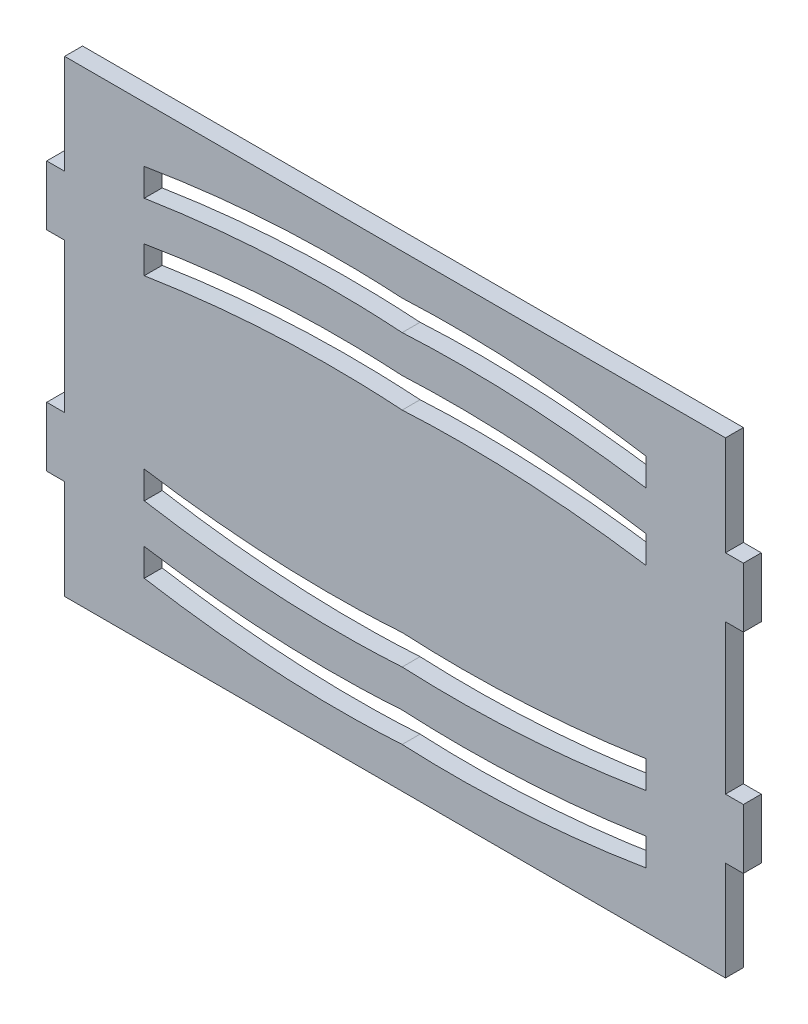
SolidWorks part; units mm, degrees
ref_plane "Front Plane" through (0, 0, 0) normal (0, 0, 1) x (1, 0, 0)
ref_plane "Top Plane" through (0, 0, 0) normal (0, 1, 0) x (1, 0, 0)
ref_plane "Right Plane" through (0, 0, 0) normal (1, 0, 0) x (0, 0, -1)
sketch "Sketch1" plane through (0, 0, 0) normal (0, 0, 1) x (1, 0, 0)
  line L1 (342, -235) -> (-342, -235)
  line L2 (342, -235) -> (342, 235)
  line L3 (342, 235) -> (-342, 235)
  line L4 (-342, -235) -> (-342, 235)
  line L5 (342, -235) -> (-342, 235) construction
  line L6 (342, 235) -> (-342, -235) construction
  point P0 (0, 0)
  dimension "D1" = 684
  dimension "D2" = 470
extrude "Boss-Extrude1" add sketch "Sketch1" along normal blind 18
sketch "Sketch2" plane through (0, 0, 0) normal (0, 0, 1) x (1, 0, 0)
  line L0 (-252, 179.19) -> (-252, 151.5066)
  line L1 (7.1609, 194.19) -> (7.1609, 164.19)
  line L2 (252, 179.19) -> (252, 151.5066)
  line L3 (-342, -33.7) -> (342, -33.7)
  line L4 (-252, 111.79) -> (-252, 84.1066)
  line L5 (342, -235) -> (342, 235) construction
  line L6 (-342, 235) -> (-342, -235) construction
  line L7 (-342, 0) -> (342, 0) construction
  line L8 (252, -179.19) -> (252, -151.5066)
  line L9 (-252, -179.19) -> (-252, -151.5066)
  line L10 (-342, 0) -> (342, 0)
  line L12 (252, 111.79) -> (252, 84.1066)
  line L13 (-342, 33.7) -> (342, 33.7)
  line L14 (-252, -111.79) -> (-252, -84.1066)
  line L15 (252, -111.79) -> (252, -84.1066)
  spline S0 degree 2 poles (-252, 179.19) (-118.0184, 201.926) (7.1609, 194.19) knots 0 0 0 0.511096 0.511096 0.511096
  spline S1 degree 2 poles (-252, 151.5066) (-117.9662, 172.5949) (7.1609, 164.19) knots 0 0 0 0.510889 0.510889 0.510889
  spline S2 degree 2 poles (252, 179.19) (125.3883, 199.9001) (7.1609, 194.19) knots 0 0 0 0.482354 0.482354 0.482354
  spline S3 degree 2 poles (252, 151.5066) (125.3402, 170.5851) (7.1609, 164.19) knots 0 0 0 0.482141 0.482141 0.482141
  spline S4 degree 2 poles (252, -151.5066) (125.3402, -170.5851) (7.1609, -164.19) knots 0 0 0 0.482141 0.482141 0.482141
  spline S5 degree 2 poles (252, -179.19) (125.3883, -199.9001) (7.1609, -194.19) knots 0 0 0 0.482354 0.482354 0.482354
  spline S6 degree 2 poles (-252, -179.19) (-118.0184, -201.926) (7.1609, -194.19) knots 0 0 0 0.511096 0.511096 0.511096
  spline S7 degree 2 poles (-252, -151.5066) (-117.9662, -172.5949) (7.1609, -164.19) knots 0 0 0 0.510889 0.510889 0.510889
  spline S8 degree 2 poles (252, 111.79) (125.3883, 132.5001) (7.1609, 126.79) knots 0 0 0 0.482354 0.482354 0.482354
  spline S9 degree 2 poles (252, 84.1066) (125.3402, 103.1851) (7.1609, 96.79) knots 0 0 0 0.482141 0.482141 0.482141
  spline S10 degree 2 poles (-252, 84.1066) (-117.9662, 105.1949) (7.1609, 96.79) knots 0 0 0 0.510889 0.510889 0.510889
  spline S11 degree 2 poles (-252, 111.79) (-118.0184, 134.526) (7.1609, 126.79) knots 0 0 0 0.511096 0.511096 0.511096
  spline S12 degree 2 poles (252, -84.1066) (125.3402, -103.1851) (7.1609, -96.79) knots 0 0 0 0.482141 0.482141 0.482141
  spline S13 degree 2 poles (252, -111.79) (125.3883, -132.5001) (7.1609, -126.79) knots 0 0 0 0.482354 0.482354 0.482354
  spline S14 degree 2 poles (-252, -84.1066) (-117.9662, -105.1949) (7.1609, -96.79) knots 0 0 0 0.510889 0.510889 0.510889
  spline S15 degree 2 poles (-252, -111.79) (-118.0184, -134.526) (7.1609, -126.79) knots 0 0 0 0.511096 0.511096 0.511096
  point P0 (-252, 179.19)
  point P1 (252, 179.19)
  point P40 (0, 0)
  dimension "D4" = 33.7
  dimension "D1" = 90
  dimension "D2" = 90
  dimension "D3" = 30
  dimension "D5" = 33.7
extrude "Cut-Extrude1" cut sketch "Sketch2" against normal blind 18 and the other way through all
sketch "Sketch3" plane through (0, 0, 0) normal (0, 0, 1) x (1, 0, 0)
  line L0 (-342, 235) -> (-342, -235) construction
  line L1 (-342, 135) -> (-332, 135)
  line L2 (-342, 135) -> (-342, 75)
  line L3 (-342, 75) -> (-332, 75)
  line L4 (0, -235) -> (0, 235)
  line L5 (342, 235) -> (-342, 235) construction
  line L6 (-342, -135) -> (-332, -135)
  line L7 (-342, -135) -> (-342, -75)
  line L8 (-342, -75) -> (-332, -75)
  line L9 (-332, -135) -> (-342, -135)
  line L10 (-342, -235) -> (342, -235) construction
  line L11 (-332, -135) -> (-332, -235)
  line L12 (-332, -235) -> (-342, -235)
  line L13 (-342, -135) -> (-342, -235)
  line L14 (-332, 75) -> (-342, 75)
  line L15 (-332, 75) -> (-332, -75)
  line L16 (-332, -75) -> (-342, -75)
  line L17 (-342, 75) -> (-342, -75)
  line L18 (-332, 135) -> (-342, 135)
  line L19 (-332, 135) -> (-332, 235)
  line L20 (-332, 235) -> (-342, 235)
  line L21 (-342, 135) -> (-342, 235)
  line L22 (332, 235) -> (342, 235)
  line L23 (342, 135) -> (332, 135)
  line L24 (342, 135) -> (342, 235)
  line L25 (332, 135) -> (332, 235)
  line L26 (342, 75) -> (342, -75)
  line L27 (342, -75) -> (332, -75)
  line L28 (332, 75) -> (332, -75)
  line L29 (342, -135) -> (332, -135)
  line L30 (332, -235) -> (342, -235)
  line L31 (342, -135) -> (342, -235)
  line L32 (332, -135) -> (332, -235)
  line L33 (342, 135) -> (342, 75)
  line L34 (342, -135) -> (342, -75)
  line L35 (342, 75) -> (332, 75)
  dimension "D1" = 10
  dimension "D2" = 60
  dimension "D3" = 100
  dimension "D4" = 100
extrude "Cut-Extrude5" cut sketch "Sketch3" along normal blind 18 contours L29 L32 L30 L31 | L26 L35 L28 L27 | L25 L23 L24 L22 | L3 L17 L8 L15 | L21 L1 L19 L20 | L11 L12 L13 L9
sketch "Sketch9" plane through (0, 0, 0) normal (0, 0, 1) x (1, 0, 0)
  line L1 (-342, 135) -> (-350, 135)
  line L2 (-342, 135) -> (-342, 75)
  line L3 (-342, 75) -> (-350, 75)
  line L4 (-350, 135) -> (-350, 75)
  line L5 (-342, -75) -> (-350, -75)
  line L6 (-342, -75) -> (-342, -135)
  line L7 (-342, -135) -> (-350, -135)
  line L8 (-350, -75) -> (-350, -135)
  line L9 (342, 135) -> (350, 135)
  line L10 (342, 135) -> (342, 75)
  line L11 (342, 75) -> (350, 75)
  line L12 (350, 135) -> (350, 75)
  line L13 (342, -75) -> (350, -75)
  line L14 (342, -75) -> (342, -135)
  line L15 (342, -135) -> (350, -135)
  line L16 (350, -75) -> (350, -135)
  dimension "D1" = 8
extrude "Boss-Extrude2" add sketch "Sketch9" along normal blind 18
